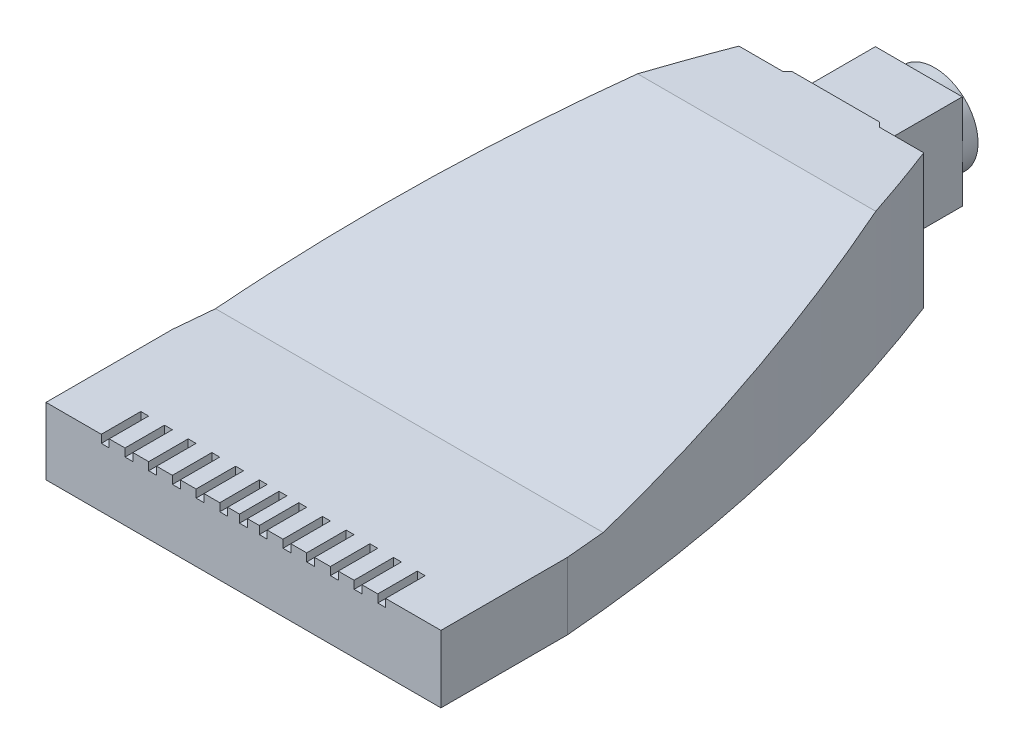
SolidWorks part; units mm, degrees
ref_plane "Front Plane" through (0, 0, 0) normal (0, 0, 1) x (1, 0, 0)
ref_plane "Top Plane" through (0, 0, 0) normal (0, 1, 0) x (1, 0, 0)
ref_plane "Right Plane" through (0, 0, 0) normal (1, 0, 0) x (0, 0, -1)
sketch "Schizzo1" plane through (0, 0, 0) normal (0, 1, 0) x (1, 0, 0)
  line L0 (-25.5, -23.9407) -> (24.5, -23.9407)
  line L1 (-0.5, -23.9407) -> (-0.5, 51.0593)
  line L2 (-0.5, 91.0608) -> (-0.5, -50.8296) construction
  line L3 (-6, 51.0593) -> (5, 51.0593)
  line L4 (-6, 51.0593) -> (-6, 61.5593)
  line L5 (-6, 61.5593) -> (5, 61.5593)
  line L6 (5, 61.5593) -> (5, 51.0593)
  line L7 (-25.5, -23.9407) -> (-25.5, -7.9407)
  line L8 (24.5, -23.9407) -> (24.5, -7.9407)
  line L9 (-12.1947, 50.4823) -> (11.1947, 50.4823)
  line L10 (5, 51.0593) -> (5.577, 50.4823)
  line L11 (-6, 51.0593) -> (-6.577, 50.4823)
  spline S0 degree 2 poles (-25.5, -7.9407) (-23.065, 22.2268) (-12.1947, 50.4823) knots 0 0 0 1 1 1
  spline S1 degree 2 poles (24.5, -7.9407) (22.065, 22.2268) (11.1947, 50.4823) knots 0 0 0 1 1 1
  dimension "D1" = 50
  dimension "D2" = 10.5
  dimension "D3" = 75
  dimension "D5" = 0
  dimension "D6" = 11
  dimension "D8" = 16
extrude "Estrusione-Estrusione1" add sketch "Schizzo1" along normal blind 17
sketch "Schizzo3" plane through (24.5, 0, 0) normal (1, 0, 0) x (0, 0, -1)
  line L0 (-23.9407, 8.5) -> (-7.9407, 8.5)
  line L1 (-23.9407, 17) -> (-23.9407, 0) construction
  line L2 (-7.9407, 17) -> (-7.9407, 0) construction
  line L3 (-7.9407, 8.5) -> (-2.9415, 8.5)
  line L4 (-2.9415, 8.5) -> (41.0271, 17)
  line L5 (50.4823, 17) -> (-7.9407, 17) construction
  line L6 (41.0271, 17) -> (50.4823, 17)
  line L7 (41.0271, 17) -> (-23.9407, 17)
  line L8 (-23.9407, 17) -> (-23.9407, 8.5)
extrude "Taglio-Estrusione2" cut sketch "Schizzo3" against normal blind 80 contours L4 L7 L3 M2 | L0 M4 M2 M3
sketch "Schizzo4" plane through (5, 0, 0) normal (1, 0, 0) x (0, 0, -1)
  line L0 (51.0593, 17) -> (51.0593, 0) construction
  line L1 (61.5593, 17) -> (51.0593, 17)
  line L2 (61.5593, 17) -> (61.5593, 14.5)
  line L3 (61.5593, 14.5) -> (51.0593, 14.5)
  line L4 (51.0593, 17) -> (51.0593, 14.5)
  line L6 (61.5593, 0) -> (51.0593, 0)
  line L7 (61.5593, 0) -> (61.5593, 2.5)
  line L8 (61.5593, 2.5) -> (51.0593, 2.5)
  line L9 (51.0593, 0) -> (51.0593, 2.5)
  dimension "D1" = 2.5
  dimension "D2" = 2.5
extrude "Taglio-Estrusione4" cut sketch "Schizzo4" against normal blind 11
sketch "Schizzo5" plane through (0, 0, -61.5593) normal (0, 0, -1) x (-1, 0, 0)
  line L0 (-5, 14.5) -> (-5, 2.5) construction
  circle A0 centre (0.5, 8.4433) radius 5.5
  dimension "D1" = 11
  dimension "D2" = 5.5
extrude "Estrusione-Estrusione2" add sketch "Schizzo5" along normal blind 2
sketch "Schizzo6" plane through (0, 8.5, 0) normal (0, 1, 0) x (1, 0, 0)
  line L0 (-25.5, -23.9407) -> (24.5, -23.9407) construction
  line L1 (-20.5, -23.9407) -> (19.5, -23.9407)
  line L2 (-20.5, -23.9407) -> (-20.5, -18.9407)
  line L3 (-20.5, -18.9407) -> (19.5, -18.9407)
  line L4 (19.5, -23.9407) -> (19.5, -18.9407)
  line L5 (24.5, -23.9407) -> (24.5, -7.9407) construction
  line L6 (-25.5, -7.9407) -> (-25.5, -23.9407) construction
  line L7 (-18.5, -23.9407) -> (-18.5, -18.9407)
  line L8 (-0.5, -27.7447) -> (-0.5, -11.4334) construction
  line L9 (-17.5, -23.9407) -> (-17.5, -18.9407)
  line L10 (-15.5, -23.9407) -> (-15.5, -18.9407)
  line L11 (-14.5, -23.9407) -> (-14.5, -18.9407)
  line L12 (-12.5, -23.9407) -> (-12.5, -18.9407)
  line L13 (-11.5, -23.9407) -> (-11.5, -18.9407)
  line L14 (-9.5, -23.9407) -> (-9.5, -18.9407)
  line L15 (-9.5, -18.9407) -> (-8.5, -18.9407)
  line L16 (-8.5, -18.9407) -> (-8.5, -23.9407)
  line L17 (-8.5, -23.9407) -> (-6.5, -23.9407)
  line L18 (-6.5, -23.9407) -> (-6.5, -18.9407)
  line L19 (-6.5, -18.9407) -> (-5.5, -18.9407)
  line L20 (-5.5, -18.9407) -> (-5.5, -23.9407)
  line L21 (-3.5, -23.9407) -> (-3.5, -18.9407)
  line L22 (-2.5, -18.9407) -> (-2.5, -23.9407)
  line L23 (1.5, -18.9407) -> (1.5, -23.9407)
  line L24 (2.5, -23.9407) -> (2.5, -18.9407)
  line L25 (4.5, -18.9407) -> (4.5, -23.9407)
  line L26 (5.5, -23.9407) -> (5.5, -18.9407)
  line L27 (7.5, -18.9407) -> (7.5, -23.9407)
  line L28 (8.5, -23.9407) -> (8.5, -18.9407)
  line L29 (10.5, -23.9407) -> (10.5, -18.9407)
  line L30 (11.5, -23.9407) -> (11.5, -18.9407)
  line L31 (13.5, -23.9407) -> (13.5, -18.9407)
  line L32 (14.5, -23.9407) -> (14.5, -18.9407)
  line L33 (16.5, -23.9407) -> (16.5, -18.9407)
  line L34 (17.5, -23.9407) -> (17.5, -18.9407)
  line L35 (-1, -23.9407) -> (-1, -18.9407)
  line L36 (-1, -18.9407) -> (0, -18.9407)
  line L37 (0, -18.9407) -> (0, -23.9407)
  dimension "D1" = 5
  dimension "D2" = 5
  dimension "D3" = 5
  dimension "D4" = 20
  dimension "D5" = 2
  dimension "D6" = 1
  dimension "D7" = 2
  dimension "D8" = 1
  dimension "D9" = 2
  dimension "D10" = 1
  dimension "D11" = 2
  dimension "D12" = 1
  dimension "D13" = 2
  dimension "D14" = 1
  dimension "D15" = 2
  dimension "D16" = 1
  dimension "D17" = 0.5
extrude "Taglio-Estrusione5" cut sketch "Schizzo6" against normal blind 1 contours L1 L9 L3 L7 | L1 L11 L3 L10 | L1 L13 L3 L12 | L16 L3 L14 L1 | L20 L3 L18 L1 | L22 L3 L21 L1 | L8 L37 L36 M3 | L1 L8 L3 L35 | L1 L24 L3 L23 | L1 L26 L3 L25 | L1 L28 L3 L27 | L1 L30 L3 L29 | L1 L32 L3 L31 | L1 L34 L3 L33
